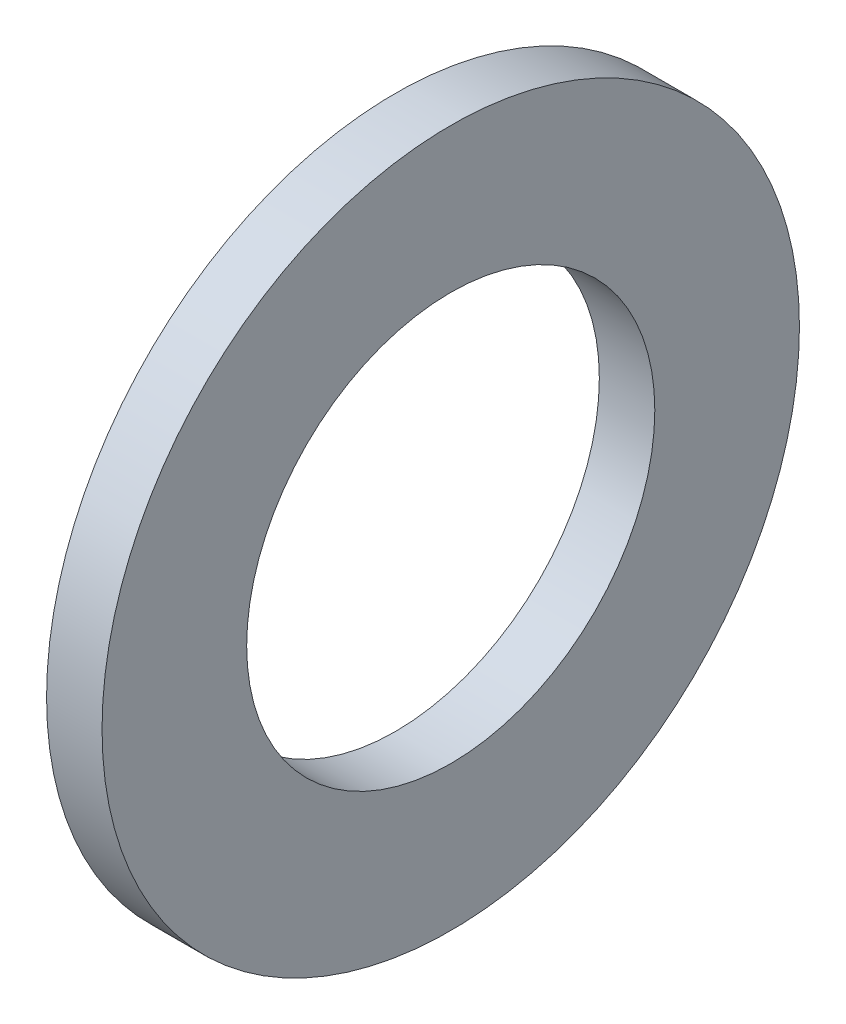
SolidWorks part; units mm, degrees
ref_plane "Front Plane" through (0, 0, 0) normal (0, 0, 1) x (1, 0, 0)
ref_plane "Top Plane" through (0, 0, 0) normal (0, 1, 0) x (1, 0, 0)
ref_plane "Right Plane" through (0, 0, 0) normal (1, 0, 0) x (0, 0, -1)
sketch "Sketch1" plane through (0, 0, 0) normal (1, 0, 0) x (0, 0, -1)
  circle A0 centre (0, 0) radius 6.5405
  circle A1 centre (0, 0) radius 11.176
  dimension "OD" = 13.081
  dimension "ID" = 22.352
extrude "Boss-Extrude1" add sketch "Sketch1" along normal blind 1.778
